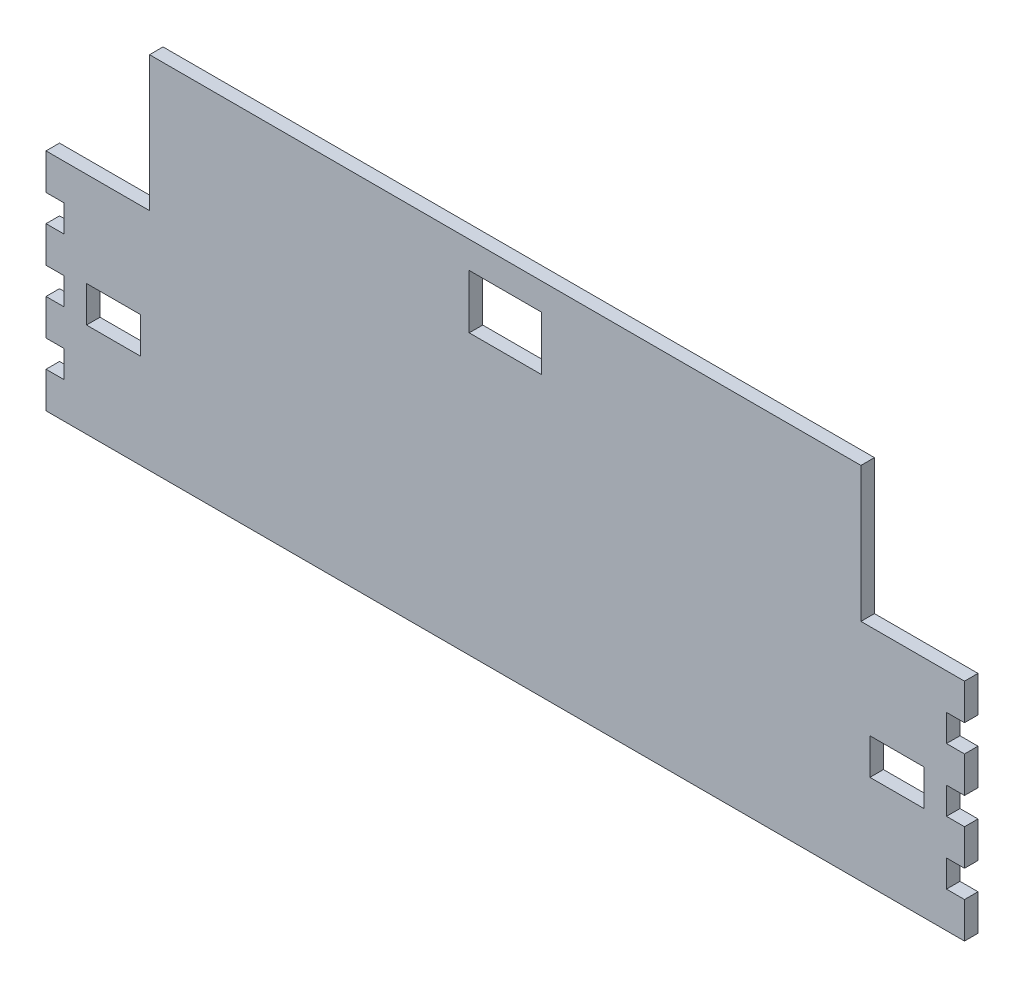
SolidWorks part; units mm, degrees
ref_plane "Plan de face" through (0, 0, 0) normal (0, 0, 1) x (1, 0, 0)
ref_plane "Plan de dessus" through (0, 0, 0) normal (0, 1, 0) x (1, 0, 0)
ref_plane "Plan de droite" through (0, 0, 0) normal (1, 0, 0) x (0, 0, -1)
sketch "Esquisse1" plane through (0, 0, 0) normal (0, 0, 1) x (1, 0, 0)
  line L0 (0, 0) -> (0, 510.6053) construction
  line L1 (-510, 0) -> (510, 0)
  line L2 (510, 0) -> (510, 40)
  line L3 (510, 40) -> (490, 40)
  line L4 (490, 40) -> (490, 70)
  line L5 (490, 70) -> (510, 70)
  line L6 (510, 70) -> (510, 110)
  line L7 (510, 110) -> (490, 110)
  line L8 (490, 110) -> (490, 140)
  line L9 (490, 140) -> (510, 140)
  line L10 (510, 140) -> (510, 180)
  line L11 (510, 180) -> (490, 180)
  line L12 (490, 180) -> (490, 210)
  line L13 (490, 210) -> (510, 210)
  line L14 (510, 210) -> (510, 250)
  line L15 (510, 250) -> (395, 250)
  line L16 (395, 250) -> (395, 400)
  line L17 (395, 400) -> (-395, 400)
  line L18 (-40, 310) -> (40, 310)
  line L19 (40, 310) -> (40, 370)
  line L20 (40, 370) -> (-40, 370)
  line L21 (-40, 310) -> (-40, 370)
  line L22 (-395, 250) -> (-395, 400)
  line L23 (-510, 250) -> (-395, 250)
  line L24 (-510, 210) -> (-510, 250)
  line L25 (-490, 210) -> (-510, 210)
  line L26 (-490, 180) -> (-490, 210)
  line L27 (-510, 180) -> (-490, 180)
  line L28 (-510, 140) -> (-510, 180)
  line L29 (-490, 140) -> (-510, 140)
  line L30 (-490, 110) -> (-490, 140)
  line L31 (-510, 110) -> (-490, 110)
  line L32 (-510, 70) -> (-510, 110)
  line L33 (-490, 70) -> (-510, 70)
  line L34 (-490, 40) -> (-490, 70)
  line L35 (-510, 40) -> (-490, 40)
  line L36 (-510, 0) -> (-510, 40)
  line L37 (465, 145) -> (465, 105)
  line L38 (-465, 145) -> (-405, 145)
  line L39 (-465, 145) -> (-465, 105)
  line L40 (-465, 105) -> (-405, 105)
  line L41 (-405, 145) -> (-405, 105)
  line L42 (465, 145) -> (405, 145)
  line L43 (405, 145) -> (405, 105)
  line L44 (465, 105) -> (405, 105)
  point P25 (0, 400)
  point P26 (0, 370)
  point P27 (0, 310)
  dimension "D1" = 400
  dimension "D2" = 60
  dimension "D3" = 310
  dimension "D4" = 40
  dimension "D5" = 510
  dimension "D6" = 20
  dimension "D7" = 40
  dimension "D8" = 30
  dimension "D9" = 110
  dimension "D10" = 30
  dimension "D11" = 30
  dimension "D12" = 180
  dimension "D13" = 250
  dimension "D14" = 395
  dimension "D15" = 105
  dimension "D16" = 40
  dimension "D17" = 405
  dimension "D18" = 60
extrude "Extrusion1" add sketch "Esquisse1" along normal blind 15
